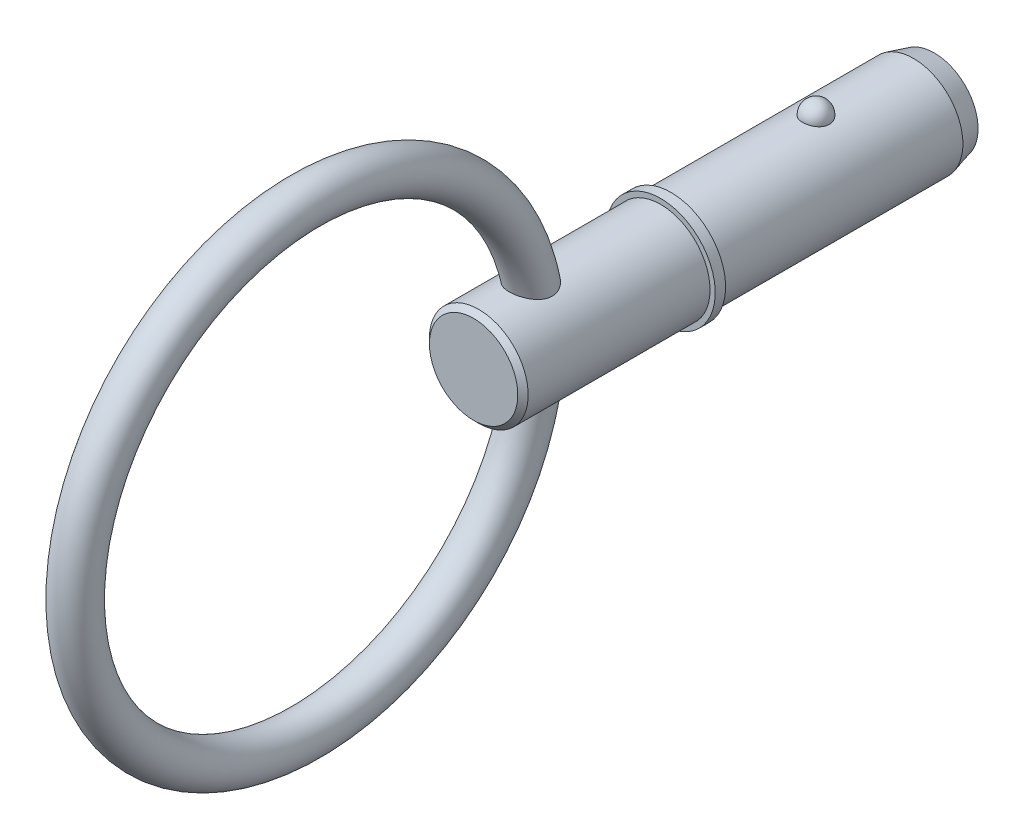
SolidWorks part; units mm, degrees
ref_plane "Front Plane" through (0, 0, 0) normal (0, 0, 1) x (1, 0, 0)
ref_plane "Top Plane" through (0, 0, 0) normal (0, 1, 0) x (1, 0, 0)
ref_plane "Right Plane" through (0, 0, 0) normal (1, 0, 0) x (0, 0, -1)
sketch "Sketch2" plane through (0, 0, 0) normal (0, 0, 1) x (1, 0, 0)
  circle A0 centre (0, 0) radius 4.765
  point P3 (0, 4.765)
  dimension "D1" = 9.53
extrude "Boss-Extrude1" add sketch "Sketch2" along normal blind 12.7
sketch "Sketch3" plane through (0, 0, 0) normal (0, 0, -1) x (-1, 0, 0)
  circle A0 centre (0, 0) radius 4.765
  dimension "D1" = 9.53
extrude "Boss-Extrude2" add sketch "Sketch3" along normal blind 12.7
chamfer "Chamfer1" distance 2 angle 15 1 edges at (-4.765, 0, -12.7)
sketch "Sketch18" plane through (0, 0, 0) normal (1, 0, 0) x (0, 0, -1)
  line L0 (10.7, 4.765) -> (-12.7, 4.765) construction
  line L1 (1.29, 6.055) -> (1.29, 3.475)
  line L2 (-12.7, -4.765) -> (10.7, -4.765) construction
  arc A0 (1.29, 6.055) -> (1.29, 3.475) centre (1.29, 4.765) ccw
  point P4 (0, 4.765)
  dimension "D1" = 10.82
revolve "Revolve1" add sketch "Sketch18" angle 360 about L1
sketch "Sketch19" plane through (0, 0, 0) normal (1, 0, 0) x (0, 0, -1)
  line L0 (-33.7288, 0) -> (-46.4542, 0) construction
sketch "Sketch20" plane through (0, 0, 0) normal (1, 0, 0) x (0, 0, -1)
  line L0 (-12.7, 0) -> (-12.7, 5.265)
  line L1 (-12.7, 4.765) -> (-12.7, -4.765) construction
  line L2 (-12.7, 5.265) -> (-13.7, 5.265)
  line L3 (-13.7, 5.265) -> (-13.7, 0)
  line L4 (-33.7288, 0) -> (-46.4542, 0) construction
  line L5 (-13.7, 0) -> (-12.7, 0)
  dimension "D1" = 5.265
  dimension "D2" = 1
revolve "Revolve2" add sketch "Sketch20" angle 360 about L0
sketch "Sketch21" plane through (0, 0, 12.7) normal (0, 0, -1) x (-1, 0, 0)
  circle A0 centre (0, 0) radius 4.765
  dimension "D1" = 9.53
extrude "Boss-Extrude3" add sketch "Sketch21" against normal blind 19.05
chamfer "Chamfer2" distance 0.5 angle 45 1 edges at (-4.765, 0, 31.75)
sketch "Sketch23" plane through (0, 0, 0) normal (1, 0, 0) x (0, 0, -1)
  line L0 (-31.75, 4.265) -> (-31.75, -4.265) construction
  circle A0 centre (-47.975, 0) radius 22.225
  point P2 (-25.75, 0)
  dimension "D1" = 44.45
  dimension "D2" = 6
sketch "Sketch24" plane through (0, 0, 0) normal (0, 1, 0) x (1, 0, 0)
  circle A0 centre (0, -25.75) radius 2
  dimension "D1" = 4
sweep "Sweep1" add profiles "Sketch24" path "Sketch23"
